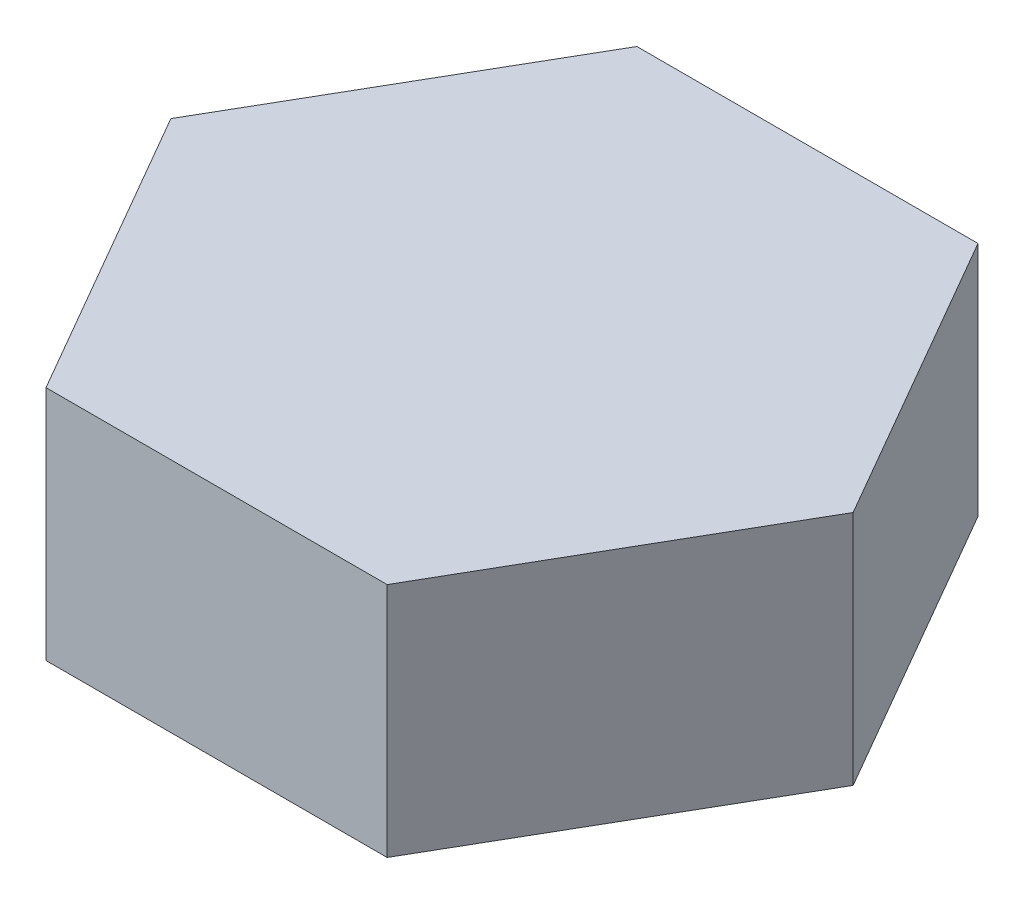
SolidWorks part; units mm, degrees
ref_plane "Front" through (0, 0, 0) normal (0, 0, 1) x (1, 0, 0)
ref_plane "Top" through (0, 0, 0) normal (0, 1, 0) x (1, 0, 0)
ref_plane "Right" through (0, 0, 0) normal (1, 0, 0) x (0, 0, -1)
sketch "Sketch1" plane through (0, 0, 0) normal (0, 1, 0) x (1, 0, 0)
  line L0 (57.735, 0) -> (28.8675, 50)
  line L1 (28.8675, 50) -> (-28.8675, 50)
  line L2 (-28.8675, 50) -> (-57.735, 0)
  line L3 (-57.735, 0) -> (-28.8675, -50)
  line L4 (-28.8675, -50) -> (28.8675, -50)
  line L5 (28.8675, -50) -> (57.735, 0)
  circle A0 centre (0, 0) radius 50 construction
extrude "Extrude1" add sketch "Sketch1" along normal blind 40
